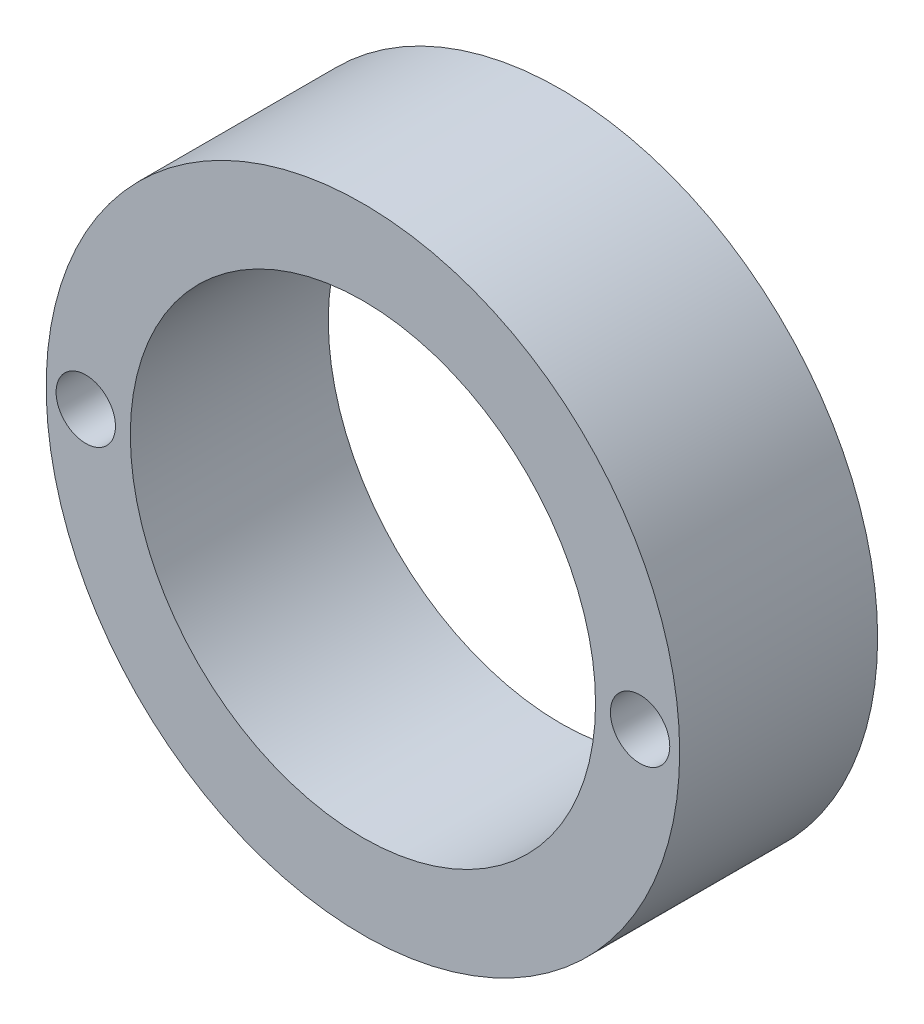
SolidWorks part; units mm, degrees
ref_plane "Plan1" through (0, 0, 0) normal (0, 0, 1) x (1, 0, 0)
ref_plane "Plan2" through (0, 0, 0) normal (0, 1, 0) x (1, 0, 0)
ref_plane "Plan3" through (0, 0, 0) normal (1, 0, 0) x (0, 0, -1)
sketch "Esquisse1" plane through (0, 0, 0) normal (0, 0, 1) x (1, 0, 0)
  circle A0 centre (0, 0) radius 32
  circle A1 centre (0, 0) radius 23.5
  circle A2 centre (-28, 0) radius 3
  circle A3 centre (28, 0) radius 3
  dimension "D1" = 64
  dimension "D2" = 28
  dimension "D4" = 47
  dimension "D5" = 6
  dimension "D3" = 28
extrude "Base-Extrusion" add sketch "Esquisse1" along normal blind 20
